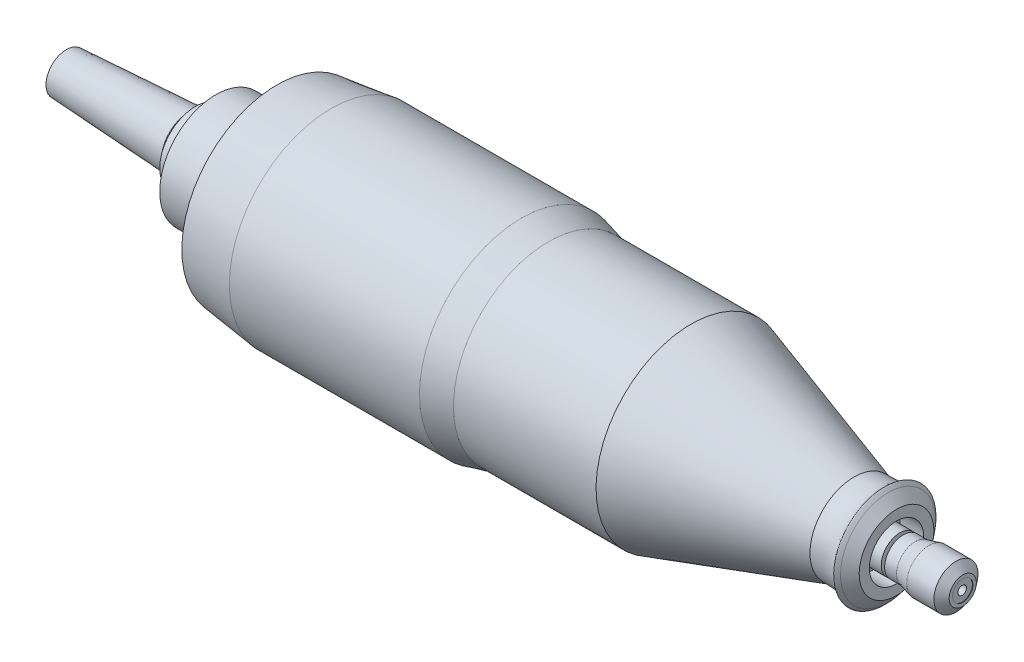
SolidWorks part; units mm, degrees
other "Camera1"
ref_plane "Front Plane" through (0, 0, 0) normal (0, 0, 1) x (1, 0, 0)
ref_plane "Top Plane" through (0, 0, 0) normal (0, 1, 0) x (1, 0, 0)
ref_plane "Right Plane" through (0, 0, 0) normal (1, 0, 0) x (0, 0, -1)
sketch "Sketch1" plane through (0, 0, 0) normal (0, 0, 1) x (1, 0, 0)
  line L0 (-6.3361, 0) -> (203.2139, 0)
  line L1 (203.2139, 0) -> (203.2139, 3.175) construction
  line L2 (203.2139, 3.175) -> (201.6264, 5.1594)
  line L3 (201.6264, 5.1594) -> (201.6264, 0) construction
  line L4 (201.6264, 5.1594) -> (195.2764, 5.1594)
  line L5 (195.2764, 5.1594) -> (192.1014, 4.3656)
  line L6 (192.1014, 4.3656) -> (189.3233, 4.3656)
  line L7 (203.2139, 2.3812) -> (203.0862, 2.3812)
  line L8 (203.0862, 2.3812) -> (203.0862, 0)
  line L9 (203.2139, 3.175) -> (203.2139, 2.3812)
  line L10 (192.1014, 4.3656) -> (192.1014, 0) construction
  line L11 (195.2764, 5.1594) -> (195.2764, 0) construction
  line L12 (189.3233, 4.3656) -> (189.3233, 3.175)
  line L13 (189.3233, 3.175) -> (188.5295, 3.175)
  line L14 (188.5295, 3.175) -> (188.5295, 4.3656)
  line L15 (188.5295, 4.3656) -> (182.1795, 4.3656)
  line L16 (182.1795, 4.3656) -> (182.1795, 6.35)
  line L17 (189.3233, 3.175) -> (189.3233, 0) construction
  line L18 (182.1795, 6.35) -> (187.7358, 6.35)
  line L19 (187.7358, 6.35) -> (187.7358, 8.7312)
  line L20 (187.7358, 8.7312) -> (185.7514, 11.1125)
  line L21 (185.7514, 11.1125) -> (185.7514, 6.35) construction
  line L22 (182.1795, 4.3656) -> (182.1795, 0) construction
  line L23 (184.1639, 11.1125) -> (185.7514, 11.1125) construction
  line L24 (177.8139, 10.3187) -> (177.8139, 0) construction
  line L25 (184.1639, 11.1125) -> (184.1639, 6.35) construction
  line L26 (177.8139, 10.3187) -> (139.7139, 22.225)
  line L27 (139.7139, 22.225) -> (139.7139, 0) construction
  line L28 (139.7139, 22.225) -> (106.3764, 22.225)
  line L29 (106.3764, 22.225) -> (100.0264, 23.8125)
  line L30 (106.3764, 22.225) -> (106.3764, 0) construction
  line L31 (100.0264, 23.8125) -> (100.0264, 0) construction
  line L32 (100.0264, 23.8125) -> (55.5764, 23.8125)
  line L33 (55.5764, 23.8125) -> (42.8764, 22.225)
  line L34 (55.5764, 23.8125) -> (55.5764, 0) construction
  line L35 (42.8764, 22.225) -> (42.8764, 0) construction
  line L36 (36.5264, 13.0969) -> (42.8764, 22.225)
  line L37 (36.5264, 13.0969) -> (28.5889, 13.0969)
  line L38 (36.5264, 13.0969) -> (36.5264, 0) construction
  line L39 (28.5889, 13.0969) -> (28.5889, 8.3344)
  line L40 (28.5889, 8.3344) -> (23.8264, 8.3344)
  line L41 (23.8264, 8.3344) -> (22.2389, 6.35)
  line L42 (23.8264, 8.3344) -> (23.8264, 0) construction
  line L43 (22.2389, 6.35) -> (22.2389, 0) construction
  line L44 (22.2389, 6.35) -> (-6.3361, 4.7625)
  line L45 (-6.3361, 4.7625) -> (-6.3361, 0)
  spline S0 degree 3 poles (185.7514, 11.1125) (184.5966, 12.4397) (185.5381, 11.7386) (182.9227, 10.4258) (181.1874, 10.3726) (177.8139, 10.3187) knots 0 0 0 0 0.659544 0.859883 1 1 1 1
  dimension "D1" = 3.175
  dimension "D2" = 1.5875
  dimension "D3" = 5.1594
  dimension "D4" = 6.35
  dimension "D5" = 0.7937
  dimension "D6" = 3.175
  dimension "D7" = 4.3656
  dimension "D8" = 2.7781
  dimension "D9" = 3.175
  dimension "D10" = 0.7937
  dimension "D11" = 6.35
  dimension "D12" = 1.9844
  dimension "D13" = 0.7937
  dimension "D14" = 2.3813
  dimension "D15" = 4.7625
  dimension "D16" = 1.9844
  dimension "D17" = 0.7937
  dimension "D18" = 0.7937
  dimension "D19" = 4.3656
  dimension "D20" = 1.5875
  dimension "D21" = 6.35
  dimension "D22" = 10.3187
  dimension "D23" = 22.225
  dimension "D24" = 38.1
  dimension "D25" = 33.3375
  dimension "D26" = 6.35
  dimension "D27" = 23.8125
  dimension "D28" = 44.45
  dimension "D29" = 57.15
  dimension "D30" = 22.225
  dimension "D31" = 13.0969
  dimension "D32" = 6.35
  dimension "D33" = 7.9375
  dimension "D34" = 4.7625
  dimension "D35" = 4.7625
  dimension "D36" = 1.5875
  dimension "D37" = 6.35
  dimension "D38" = 4.7625
  dimension "D39" = 28.575
revolve "Revolve1" add sketch "Sketch1" angle 360 about L0
sketch "Sketch2" plane through (203.0862, 0, 0) normal (1, 0, 0) x (0, 0, -1)
  circle A0 centre (0, 0) radius 1.016
  dimension "D1" = 2.032
extrude "Cut-Extrude1" cut sketch "Sketch2" against normal blind 2.54
